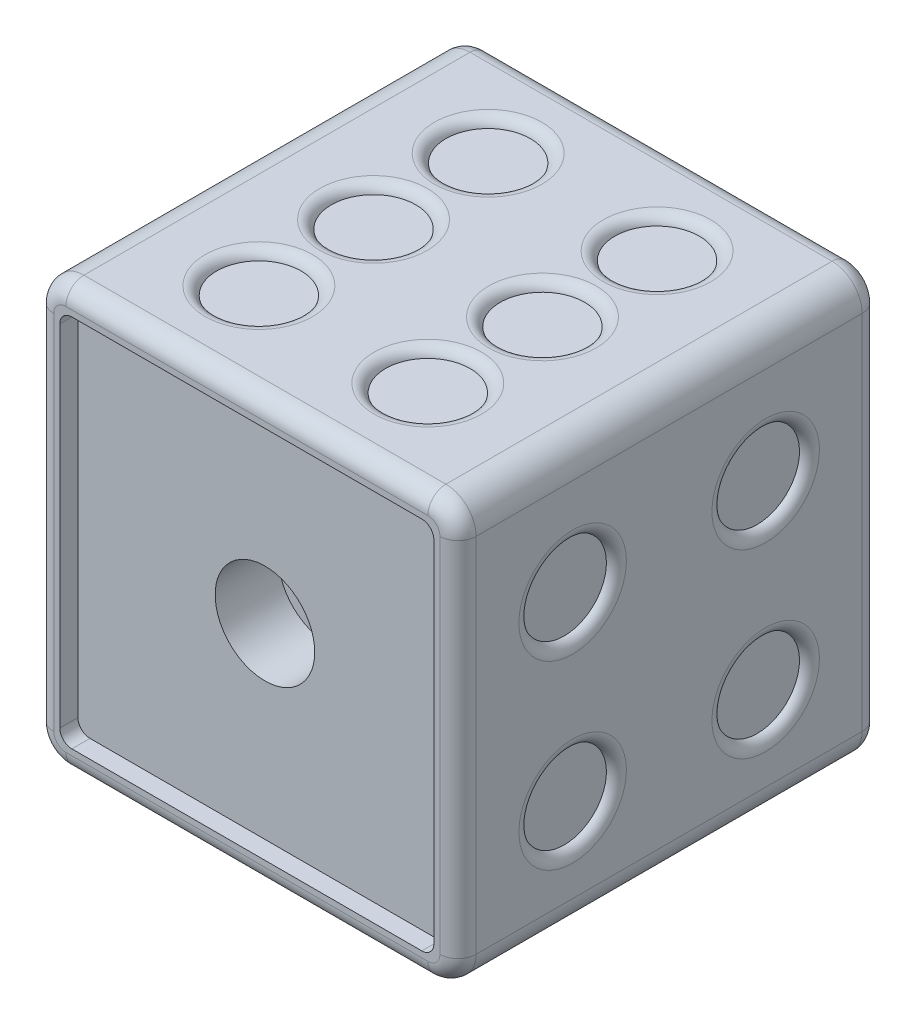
SolidWorks part; units mm, degrees
ref_plane "Front Plane" through (0, 0, 0) normal (0, 0, 1) x (1, 0, 0)
ref_plane "Top Plane" through (0, 0, 0) normal (0, 1, 0) x (1, 0, 0)
ref_plane "Right Plane" through (0, 0, 0) normal (1, 0, 0) x (0, 0, -1)
sketch "Sketch1" plane through (0, 0, 0) normal (0, 0, 1) x (1, 0, 0)
  line L1 (17.5, -17.5) -> (-17.5, -17.5)
  line L2 (17.5, -17.5) -> (17.5, 17.5)
  line L3 (17.5, 17.5) -> (-17.5, 17.5)
  line L4 (-17.5, -17.5) -> (-17.5, 17.5)
  line L5 (17.5, -17.5) -> (-17.5, 17.5) construction
  line L6 (17.5, 17.5) -> (-17.5, -17.5) construction
  point P0 (0, 0)
  dimension "D1" = 35
  dimension "D2" = 35
extrude "Boss-Extrude1" add sketch "Sketch1" along normal blind 35
sketch "Sketch2" plane through (0, 0, 35) normal (0, 0, 1) x (1, 0, 0)
  line L1 (15.5, -15.5) -> (-15.5, -15.5)
  line L2 (15.5, -15.5) -> (15.5, 15.5)
  line L3 (15.5, 15.5) -> (-15.5, 15.5)
  line L4 (-15.5, -15.5) -> (-15.5, 15.5)
  line L5 (15.5, -15.5) -> (-15.5, 15.5) construction
  line L6 (15.5, 15.5) -> (-15.5, -15.5) construction
  point P0 (0, 0)
  dimension "D1" = 31
  dimension "D2" = 31
extrude "Cut-Extrude1" cut sketch "Sketch2" against normal blind 1.5
fillet "Fillet1" radius 1 4 edges at (-15.5, -15.5, 34.25) (15.5, -15.5, 34.25) (15.5, 15.5, 34.25) (-15.5, 15.5, 34.25)
sketch "Sketch11" plane through (0, 0, 33.5) normal (0, 0, 1) x (1, 0, 0)
  circle A0 centre (0, 0) radius 4.125
  dimension "D1" = 8.25
extrude "Cut-Extrude6" cut sketch "Sketch11" against normal blind 5.25
fillet "Fillet3" radius 2.5 4 edges at (-17.5, 17.5, 17.5) (17.5, 17.5, 17.5) (17.5, -17.5, 17.5) (-17.5, -17.5, 17.5)
fillet "Fillet4" radius 1.5 16 edges at (-16.7678, -16.7678, 0) (-17.5, 0, 0) (-16.7678, 16.7678, 0) (0, 17.5, 0) (16.7678, 16.7678, 0) (17.5, 0, 0) (16.7678, -16.7678, 0) (0, -17.5, 0) (-16.7678, -16.7678, 35) (-17.5, 0, 35) (-16.7678, 16.7678, 35) (0, 17.5, 35) (16.7678, 16.7678, 35) (17.5, 0, 35) (16.7678, -16.7678, 35) (0, -17.5, 35)
sketch "Sketch13" plane through (0, -17.5, 0) normal (0, -1, 0) x (1, 0, 0)
  line L0 (-15, 17.5) -> (15, 17.5) construction
  line L1 (-15, 33.5) -> (-15, 1.5) construction
  line L2 (15, 1.5) -> (15, 33.5) construction
  circle A0 centre (0, 17.5) radius 3.5
  dimension "D1" = 7
extrude "1" cut sketch "Sketch13" against normal blind 0.7
sketch "Sketch14" plane through (17.5, 0, 0) normal (1, 0, 0) x (0, 0, -1)
  line L0 (-17.5, 15) -> (-17.5, -15) construction
  line L1 (-1.5, 15) -> (-33.5, 15) construction
  line L2 (-33.5, -15) -> (-1.5, -15) construction
  line L3 (-33.5, 15) -> (-33.5, -15) construction
  circle A0 centre (-25.5, 7) radius 3.5
  circle A1 centre (-25.5, -8) radius 3.5
  circle A2 centre (-9.5, -8) radius 3.5
  circle A3 centre (-9.5, 7) radius 3.5
  dimension "D1" = 7
  dimension "D2" = 7
  dimension "D3" = 8
  dimension "D4" = 8
  dimension "D5" = 8
  dimension "D6" = 7
extrude "4" cut sketch "Sketch14" against normal blind 0.7
sketch "Sketch15" plane through (0, 0, 0) normal (0, 0, -1) x (-1, 0, 0)
  line L0 (-16, 0) -> (16, 0) construction
  line L1 (-16, 15) -> (-16, -15) construction
  line L2 (16, -15) -> (16, 15) construction
  line L3 (0, 16) -> (0, -16) construction
  line L4 (15, 16) -> (-15, 16) construction
  line L5 (-15, -16) -> (15, -16) construction
  circle A0 centre (0, 0) radius 3.5
  circle A1 centre (-8, 9) radius 3.5
  circle A2 centre (-8, -9) radius 3.5
  circle A3 centre (8, -9) radius 3.5
  circle A4 centre (8, 9) radius 3.5
  dimension "D1" = 7
  dimension "D2" = 7
  dimension "D3" = 8
  dimension "D4" = 7
extrude "5" cut sketch "Sketch15" against normal blind 0.7
sketch "Sketch16" plane through (-17.5, 0, 0) normal (-1, 0, 0) x (0, 0, 1)
  line L0 (1.5, -15) -> (33.5, 15) construction
  line L1 (1.5, 15) -> (1.5, -15) construction
  line L2 (33.5, 15) -> (1.5, 15) construction
  circle A0 centre (17.5, 0) radius 3.5
  circle A1 centre (9.5, 8) radius 3.5
  circle A2 centre (24.9678, -8.499) radius 3.5
  dimension "D1" = 7
  dimension "D2" = 7
  dimension "D3" = 8
  dimension "D4" = 7
extrude "3" cut sketch "Sketch16" against normal blind 0.7
sketch "Sketch17" plane through (0, 17.5, 0) normal (0, 1, 0) x (1, 0, 0)
  line L0 (0, -1.5) -> (0, -33.5) construction
  line L1 (15, -1.5) -> (-15, -1.5) construction
  line L2 (-15, -33.5) -> (15, -33.5) construction
  line L3 (-15, -17.5) -> (15, -17.5) construction
  line L4 (-15, -1.5) -> (-15, -33.5) construction
  line L5 (15, -33.5) -> (15, -1.5) construction
  circle A0 centre (-7, -8) radius 3.5
  circle A1 centre (-7, -17.5) radius 3.5
  circle A2 centre (-7, -27) radius 3.5
  circle A3 centre (7, -27) radius 3.5
  circle A4 centre (7, -17.5) radius 3.5
  circle A5 centre (7, -8) radius 3.5
  dimension "D1" = 7
  dimension "D2" = 7
  dimension "D3" = 6.5
  dimension "D4" = 8
  dimension "D5" = 8
extrude "6" cut sketch "Sketch17" against normal blind 0.7
fillet "Fillet7" radius 1 19 edges at (-11.5, -9, 0) (11.5, -9, 0) (-3.5, 0, 0) (-4.5, 9, 0) (4.5, 9, 0) (3.5, 17.5, 27) (10.5, 17.5, 17.5) (10.5, 17.5, 8) (-10.5, 17.5, 8) (-10.5, 17.5, 17.5) (-3.5, 17.5, 27) (-17.5, 8, 13) (-17.5, 0, 21) (-17.5, -8.499, 21.4678) (3.5, -17.5, 17.5) (17.5, -4.5, 25.5) (17.5, -11.5, 9.5) (17.5, 3.5, 9.5) (17.5, 10.5, 25.5)
